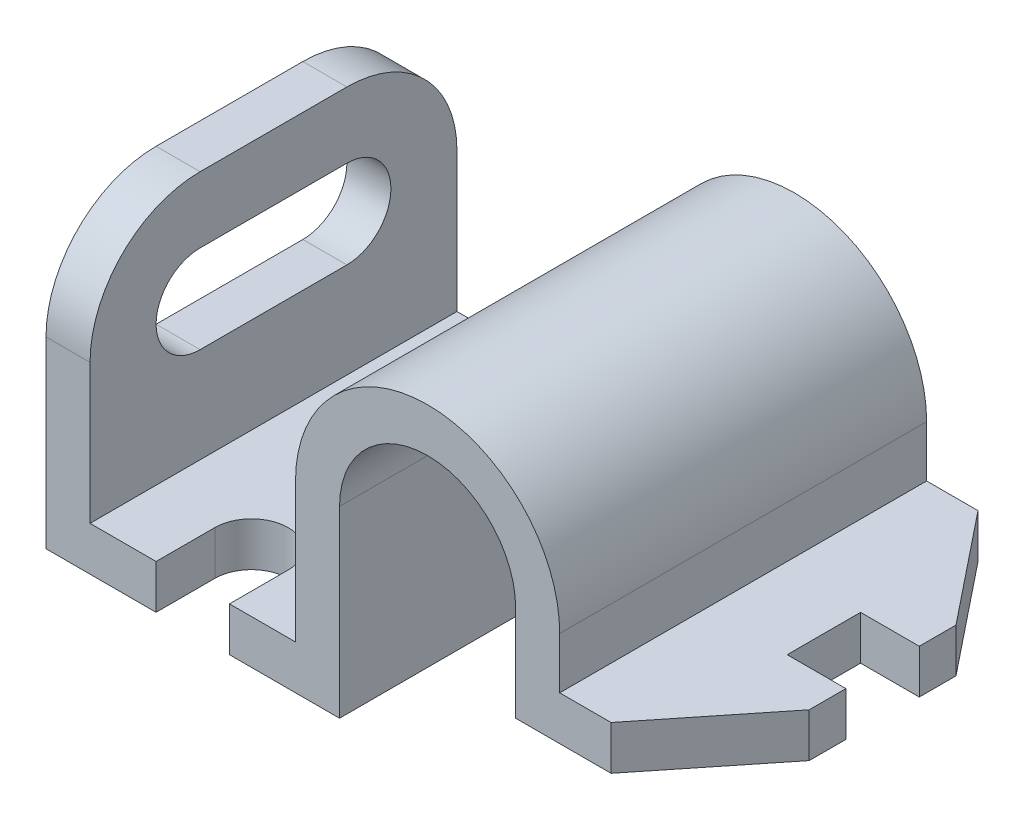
SolidWorks part; units mm, degrees
ref_plane "Alzado" through (0, 0, 0) normal (0, 0, 1) x (1, 0, 0)
ref_plane "Planta" through (0, 0, 0) normal (0, 1, 0) x (1, 0, 0)
ref_plane "Vista lateral" through (0, 0, 0) normal (1, 0, 0) x (0, 0, -1)
sketch "Croquis1" plane through (0, 0, 0) normal (0, 0, 1) x (1, 0, 0)
  line L0 (0, 40) -> (0, 0)
  line L1 (0, 0) -> (40, 0)
  line L2 (40, 0) -> (40, 25)
  line L3 (64, 25) -> (64, 12)
  line L4 (64, 12) -> (89, 12)
  arc A0 (40, 25) -> (64, 25) centre (52, 25) cw
  dimension "D1" = 40
  dimension "D2" = 40
  dimension "D3" = 24
  dimension "D4" = 25
  dimension "D5" = 12
  dimension "D6" = 25
extrude "Extruir-Lámina1" add sketch "Croquis1" along normal mid plane 50 thin
sketch "Croquis2" plane through (0, 0, 0) normal (-1, 0, 0) x (0, 0, 1)
  line L0 (-10, 25) -> (10, 25) construction
  line L1 (-10, 31) -> (10, 31)
  line L2 (-10, 19) -> (10, 19)
  line L3 (0, 25) -> (0, 0) construction
  line L4 (25, 0) -> (-25, 0) construction
  line L5 (25, 40) -> (-25, 40) construction
  line L6 (25, 40) -> (25, 0) construction
  arc A0 (-10, 31) -> (-10, 19) centre (-10, 25) ccw
  arc A1 (10, 19) -> (10, 31) centre (10, 25) ccw
  point P2 (0, 25)
  dimension "D2" = 6
  dimension "D1" = 15
  dimension "D3" = 15
extrude "Cortar-Extruir1" cut sketch "Croquis2" against normal up to next
sketch "Croquis3" plane through (0, 6, 0) normal (0, 1, 0) x (1, 0, 0)
  line L0 (15, -25) -> (15, -17)
  line L1 (6, -25) -> (34, -25) construction
  line L2 (25, -17) -> (25, -25)
  line L3 (25, -25) -> (15, -25)
  arc A0 (15, -17) -> (25, -17) centre (20, -17) cw
  point P6 (20, -25)
  dimension "D1" = 10
  dimension "D2" = 8
extrude "Cortar-Extruir2" cut sketch "Croquis3" against normal through all
sketch "Croquis4" plane through (0, 18, 0) normal (0, 1, 0) x (1, 0, 0)
  line L0 (89, -25) -> (89, 25) construction
  line L1 (89, -5) -> (81, -5)
  line L2 (89, -5) -> (89, 5)
  line L3 (89, 5) -> (81, 5)
  line L4 (81, -5) -> (81, 5)
  line L5 (81, 0) -> (0, 0) construction
  dimension "D1" = 10
  dimension "D2" = 8
extrude "Cortar-Extruir3" cut sketch "Croquis4" against normal through all
fillet "Redondeo1" radius 15 1 edges at (3, 40, 25)
chamfer "Chaflán1" distance 12 distance2 15 1 edges at (89, 15, 25)
ref_plane "Plano1" through (0, 0, 0) normal (0, 0, 1) x (1, 0, 0)
mirror "Simetría2" about plane through (0, 0, 0) normal (0, 0, 1) of "Chaflán1", "Redondeo1", "Cortar-Extruir2"
